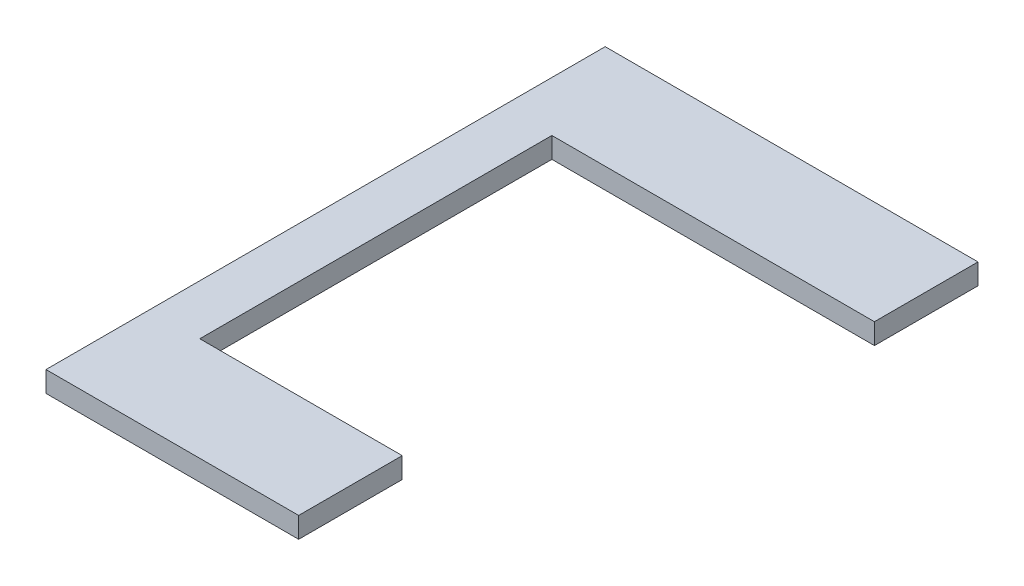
SolidWorks part; units mm, degrees
ref_plane "Ön Düzlem" through (0, 0, 0) normal (0, 0, 1) x (1, 0, 0)
ref_plane "Üst Düzlem" through (0, 0, 0) normal (0, 1, 0) x (1, 0, 0)
ref_plane "Sağ Düzlem" through (0, 0, 0) normal (1, 0, 0) x (0, 0, -1)
sketch "Çizim1" plane through (0, 0, 0) normal (0, 1, 0) x (1, 0, 0)
  line L0 (0, 0) -> (0, 1350)
  line L1 (0, 0) -> (600, 0)
  line L2 (600, 0) -> (600, 250)
  line L3 (600, 250) -> (121.2928, 250)
  line L4 (121.2928, 250) -> (121.2928, 1100)
  line L5 (0, 1350) -> (900, 1350)
  line L6 (900, 1350) -> (900, 1100)
  line L7 (900, 1100) -> (121.2928, 1100)
  dimension "D1" = 1350
  dimension "D2" = 600
  dimension "D3" = 250
  dimension "D4" = 900
  dimension "D5" = 250
extrude "Yükseklik-Ekstrüzyon1" add sketch "Çizim1" along normal blind 50
sketch "Çizim2" plane through (600, 0, 0) normal (1, 0, 0) x (0, 0, -1)
  line L0 (250, 50) -> (0, 50)
  line L1 (0, 50) -> (0, 0)
  line L2 (0, 0) -> (250, 0)
  line L3 (250, 0) -> (250, 50)
extrude "Yükseklik-Ekstrüzyon2" add sketch "Çizim2" along normal blind 10
